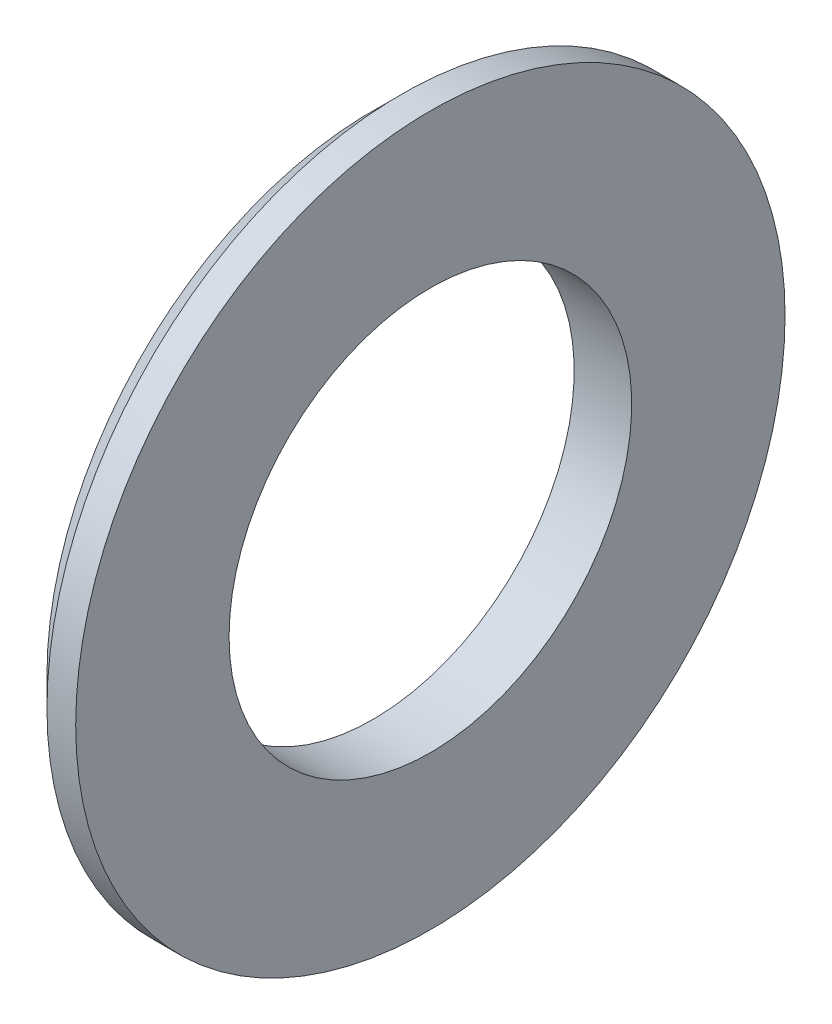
SolidWorks part; units mm, degrees
ref_plane "Plane1" through (0, 0, 0) normal (0, 0, 1) x (1, 0, 0)
ref_plane "Plane2" through (0, 0, 0) normal (0, 1, 0) x (1, 0, 0)
ref_plane "Plane3" through (0, 0, 0) normal (1, 0, 0) x (0, 0, -1)
revolve "Base-Revolve" add sketch "Sketch1" angle 360 about L0
sketch "Sketch1" plane through (0, 0, 0) normal (0, 0, 1) x (1, 0, 0)
  line L0 (-34.925, 0) -> (9.525, 0) construction
  line L1 (0, 10.5) -> (0, 18.5)
  line L2 (0, 18.5) -> (-1.5, 18.5)
  line L3 (-3, 17) -> (-3, 10.5)
  line L4 (-3, 10.5) -> (0, 10.5)
  line L5 (-3, 17) -> (-1.5, 18.5)
  dimension "D2" = 45
  dimension "D3" = 1.5
  dimension "Thickness" = 3
  dimension "Inside_dia" = 21
  dimension "Outside_dia" = 37
equation "\"D3@Sketch1\" = \"Thickness@Sketch1\" * .5"
